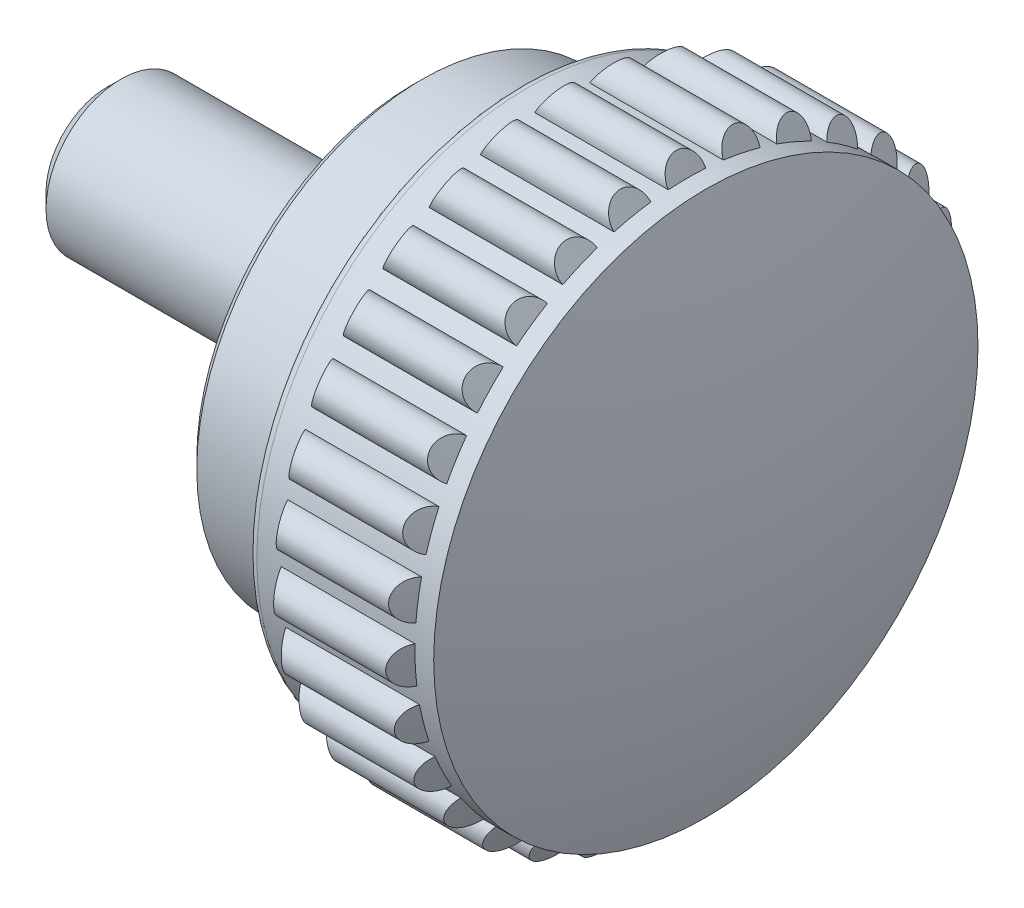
SolidWorks part; units mm, degrees
ref_plane "Plan de face" through (0, 0, 0) normal (0, 0, 1) x (1, 0, 0)
ref_plane "Plan de dessus" through (0, 0, 0) normal (0, 1, 0) x (1, 0, 0)
ref_plane "Plan de droite" through (0, 0, 0) normal (1, 0, 0) x (0, 0, -1)
ref_plane "Plan4" through (0, 0, 0) normal (0, 0, 1) x (1, 0, 0)
sketch "Esquisse1" plane through (0, 0, 0) normal (0, 0, 1) x (1, 0, 0)
  line L0 (0, 0) -> (0, 4.4444)
  line L1 (0, 4.4444) -> (0.3, 4.4444)
  line L2 (0.3, 4.4444) -> (0.3, 11.5)
  line L3 (0.3, 11.5) -> (0.8, 12)
  line L4 (0.8, 12) -> (6, 12)
  line L5 (6, 12) -> (6, 14)
  line L6 (6.5, 14.5) -> (7.8, 14.5)
  line L7 (7.8, 14.5) -> (8.666, 16)
  line L8 (8.666, 16) -> (14.0576, 16)
  line L9 (14.0576, 16) -> (14.9236, 14.5)
  line L10 (14.9236, 14.5) -> (15.9236, 14.5)
  line L11 (18, 0) -> (0, 0)
  line L12 (18, 0) -> (0, 0) construction
  arc A0 (6, 14) -> (6.5, 14.5) centre (6.5, 14) cw
  arc A1 (15.9236, 14.5) -> (18, 0) centre (-33.6667, 0) cw
revolve "Révolution1" add sketch "Esquisse1" angle 360 about L12
ref_plane "Plan5" through (0, 0, 0) normal (1, 0, 0) x (0, 0, -1)
sketch "Esquisse2" plane through (0, 0, 0) normal (1, 0, 0) x (0, 0, -1)
  circle A0 centre (0, 0) radius 20.6667
  arc A1 (-14.4976, 0.2655) -> (-14.3963, -1.7308) centre (-14.4814, -0.7344) ccw
  arc A2 (-14.3963, -1.7308) -> (-14.2542, -2.6583) centre (0, 0) ccw
  arc A3 (-14.2542, -2.6583) -> (-13.7532, -4.5933) centre (-14.0371, -3.6345) ccw
  arc A4 (-13.7532, -4.5933) -> (-13.4273, -5.4733) centre (0, 0) ccw
  arc A5 (-13.4273, -5.4733) -> (-12.5471, -7.2678) centre (-13.0182, -6.3857) ccw
  arc A6 (-12.5471, -7.2678) -> (-12.0507, -8.0641) centre (0, 0) ccw
  arc A7 (-12.0507, -8.0641) -> (-10.8272, -9.6447) centre (-11.4662, -8.8755) ccw
  arc A8 (-10.8272, -9.6447) -> (-10.1807, -10.3248) centre (0, 0) ccw
  arc A9 (-10.1807, -10.3248) -> (-8.6641, -11.6268) centre (-9.4449, -11.002) ccw
  arc A10 (-8.6641, -11.6268) -> (-7.894, -12.1629) centre (0, 0) ccw
  arc A11 (-7.894, -12.1629) -> (-6.1463, -13.1329) centre (-7.0369, -12.678) ccw
  arc A12 (-6.1463, -13.1329) -> (-5.284, -13.5029) centre (0, 0) ccw
  arc A13 (-5.284, -13.5029) -> (-3.3769, -14.1013) centre (-4.3408, -13.835) ccw
  arc A14 (-3.3769, -14.1013) -> (-2.4577, -14.2902) centre (0, 0) ccw
  arc A15 (-2.4577, -14.2902) -> (-0.4692, -14.4924) centre (-1.4669, -14.4256) ccw
  arc A16 (-0.4692, -14.4924) -> (0.4692, -14.4924) centre (0, 0) ccw
  arc A17 (0.4692, -14.4924) -> (2.4577, -14.2902) centre (1.4669, -14.4256) ccw
  arc A18 (2.4577, -14.2902) -> (3.3769, -14.1013) centre (0, 0) ccw
  arc A19 (3.3769, -14.1013) -> (5.284, -13.5029) centre (4.3408, -13.835) ccw
  arc A20 (5.284, -13.5029) -> (6.1463, -13.1329) centre (0, 0) ccw
  arc A21 (6.1463, -13.1329) -> (7.894, -12.1629) centre (7.0369, -12.678) ccw
  arc A22 (7.894, -12.1629) -> (8.6641, -11.6268) centre (0, 0) ccw
  arc A23 (8.6641, -11.6268) -> (10.1807, -10.3248) centre (9.4449, -11.002) ccw
  arc A24 (10.1807, -10.3248) -> (10.8272, -9.6447) centre (0, 0) ccw
  arc A25 (10.8272, -9.6447) -> (12.0507, -8.0641) centre (11.4662, -8.8755) ccw
  arc A26 (12.0507, -8.0641) -> (12.5471, -7.2678) centre (0, 0) ccw
  arc A27 (12.5471, -7.2678) -> (13.4273, -5.4733) centre (13.0182, -6.3857) ccw
  arc A28 (13.4273, -5.4733) -> (13.7532, -4.5933) centre (0, 0) ccw
  arc A29 (13.7532, -4.5933) -> (14.2542, -2.6583) centre (14.0371, -3.6345) ccw
  arc A30 (14.2542, -2.6583) -> (14.3963, -1.7308) centre (0, 0) ccw
  arc A31 (14.3963, -1.7308) -> (14.4976, 0.2655) centre (14.4814, -0.7344) ccw
  arc A32 (14.4976, 0.2655) -> (14.45, 1.2026) centre (0, 0) ccw
  arc A33 (14.45, 1.2026) -> (14.1474, 3.1784) centre (14.3328, 2.1957) ccw
  arc A34 (14.1474, 3.1784) -> (13.9122, 4.0868) centre (0, 0) ccw
  arc A35 (13.9122, 4.0868) -> (13.218, 5.9611) centre (13.5974, 5.0359) ccw
  arc A36 (13.218, 5.9611) -> (12.8047, 6.8036) centre (0, 0) ccw
  arc A37 (12.8047, 6.8036) -> (11.7474, 8.4999) centre (12.3053, 7.67) ccw
  arc A38 (11.7474, 8.4999) -> (11.1731, 9.2419) centre (0, 0) ccw
  arc A39 (11.1731, 9.2419) -> (9.7959, 10.6906) centre (10.5095, 9.99) ccw
  arc A40 (9.7959, 10.6906) -> (9.084, 11.3018) centre (0, 0) ccw
  arc A41 (9.084, 11.3018) -> (7.4434, 12.4437) centre (8.2834, 11.9011) ccw
  arc A42 (7.4434, 12.4437) -> (6.623, 12.8991) centre (0, 0) ccw
  arc A43 (6.623, 12.8991) -> (4.7862, 13.6873) centre (5.7182, 13.3249) ccw
  arc A44 (4.7862, 13.6873) -> (3.8908, 13.9682) centre (0, 0) ccw
  arc A45 (3.8908, 13.9682) -> (1.9329, 14.3706) centre (2.9188, 14.2032) ccw
  arc A46 (1.9329, 14.3706) -> (0.9994, 14.4655) centre (0, 0) ccw
  arc A47 (0.9994, 14.4655) -> (-0.9994, 14.4655) centre (0, 14.5) ccw
  arc A48 (-0.9994, 14.4655) -> (-1.9329, 14.3706) centre (0, 0) ccw
  arc A49 (-1.9329, 14.3706) -> (-3.8908, 13.9682) centre (-2.9188, 14.2032) ccw
  arc A50 (-3.8908, 13.9682) -> (-4.7862, 13.6873) centre (0, 0) ccw
  arc A51 (-4.7862, 13.6873) -> (-6.623, 12.8991) centre (-5.7182, 13.3249) ccw
  arc A52 (-6.623, 12.8991) -> (-7.4434, 12.4437) centre (0, 0) ccw
  arc A53 (-7.4434, 12.4437) -> (-9.084, 11.3018) centre (-8.2834, 11.9011) ccw
  arc A54 (-9.084, 11.3018) -> (-9.7959, 10.6906) centre (0, 0) ccw
  arc A55 (-9.7959, 10.6906) -> (-11.1731, 9.2419) centre (-10.5095, 9.99) ccw
  arc A56 (-11.1731, 9.2419) -> (-11.7474, 8.4999) centre (0, 0) ccw
  arc A57 (-11.7474, 8.4999) -> (-12.8047, 6.8036) centre (-12.3053, 7.67) ccw
  arc A58 (-12.8047, 6.8036) -> (-13.218, 5.9611) centre (0, 0) ccw
  arc A59 (-13.218, 5.9611) -> (-13.9122, 4.0868) centre (-13.5974, 5.0359) ccw
  arc A60 (-13.9122, 4.0868) -> (-14.1474, 3.1784) centre (0, 0) ccw
  arc A61 (-14.1474, 3.1784) -> (-14.45, 1.2026) centre (-14.3328, 2.1957) ccw
  arc A62 (-14.45, 1.2026) -> (-14.4976, 0.2655) centre (0, 0) ccw
extrude "Enlèv. mat.-Extru.1" cut sketch "Esquisse2" along normal blind 18
ref_plane "Plan6" through (0, 0, 0) normal (0, 0, 1) x (1, 0, 0)
sketch "Esquisse3" plane through (0, 0, 0) normal (0, 0, 1) x (1, 0, 0)
  line L0 (-16, 0) -> (-16, 3.233)
  line L1 (-16, 3.233) -> (-15.233, 4)
  line L2 (-15.233, 4) -> (1, 4)
  line L3 (1, 4) -> (1, 0)
  line L4 (1, 0) -> (-16, 0)
  line L5 (1, 0) -> (-16, 0) construction
revolve "Révolution2" add sketch "Esquisse3" angle 360 about L5
